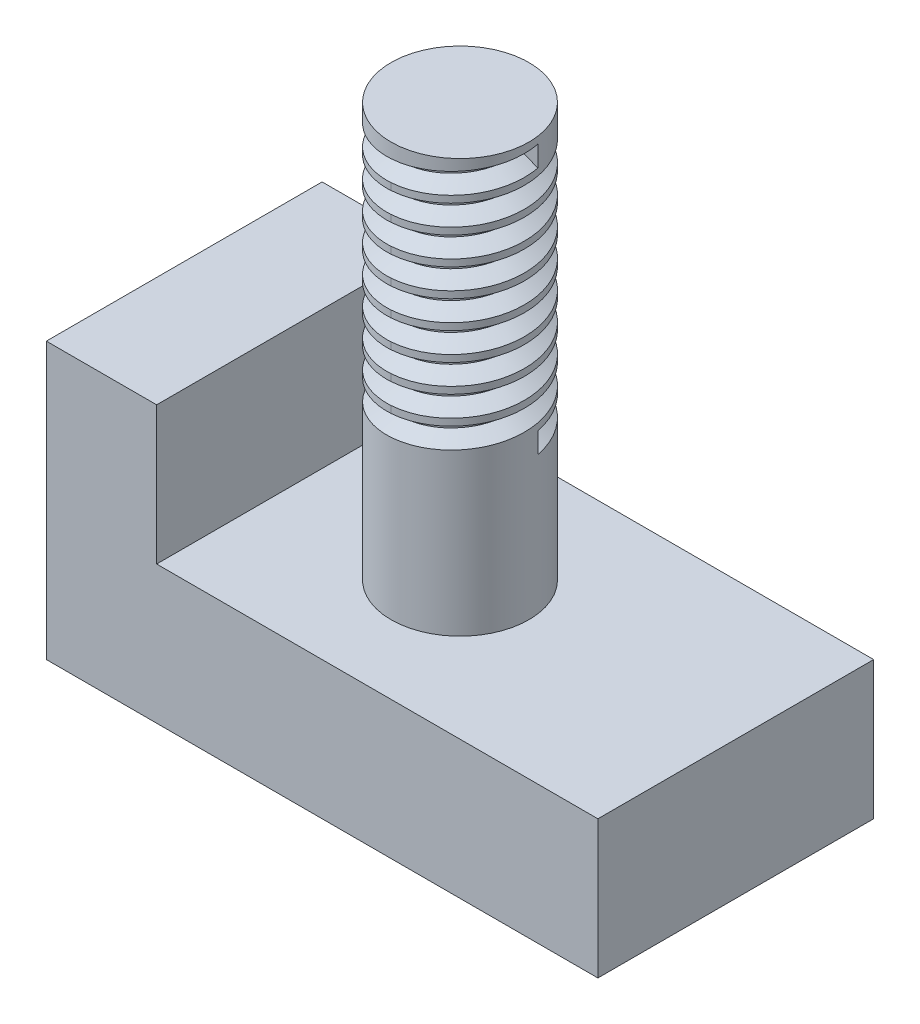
SolidWorks part; units mm, degrees
ref_plane "Front Plane" through (0, 0, 0) normal (0, 0, 1) x (1, 0, 0)
ref_plane "Top Plane" through (0, 0, 0) normal (0, 1, 0) x (1, 0, 0)
ref_plane "Right Plane" through (0, 0, 0) normal (1, 0, 0) x (0, 0, -1)
sketch "Sketch1" plane through (0, 0, 0) normal (0, 1, 0) x (1, 0, 0)
  circle A0 centre (0, 0) radius 2.5
  dimension "D1" = 5
extrude "Boss-Extrude1" add sketch "Sketch1" along normal blind 15
sketch "Sketch4" plane through (0, 0, 0) normal (0, -1, 0) x (1, 0, 0)
  line L1 (-10, -5) -> (10, -5)
  line L2 (-10, -5) -> (-10, 5)
  line L3 (-10, 5) -> (10, 5)
  line L4 (10, -5) -> (10, 5)
  line L5 (-10, -5) -> (10, 5) construction
  line L6 (-10, 5) -> (10, -5) construction
  point P0 (0, 0)
  dimension "D1" = 20
  dimension "D2" = 10
extrude "Boss-Extrude2" add sketch "Sketch4" along normal blind 5
sketch "Sketch5" plane through (0, 0, 0) normal (0, 1, 0) x (1, 0, 0)
  line L0 (10, -5) -> (-10, -5) construction
  line L1 (-10, 5) -> (-6, 5)
  line L2 (-10, 5) -> (-10, -5)
  line L3 (-10, -5) -> (-6, -5)
  line L4 (-6, 5) -> (-6, -5)
  point P7 (-10, 0)
  dimension "D1" = 4
extrude "Boss-Extrude3" add sketch "Sketch5" along normal blind 5
thread "Thread4" pitch 1 start angle 8, offset 0, length 9, pitch 1, diameter 5
ref_plane "Plane8" through (2.4757, 5, -0.3479) normal (0.1392, 0, 0.9903) x (0.9903, 0, -0.1392)
sketch "Thread Profile8" plane through (2.4757, 5, -0.3479) normal (0.1392, 0, 0.9903) x (0.9903, 0, -0.1392)
  line L0 (0, 0) -> (0, 1) construction
  line L1 (0, 0.75) -> (-0.5413, 0.4375)
  line L2 (-0.5413, 0.4375) -> (-0.5413, 0.3125)
  line L3 (-0.5413, 0.3125) -> (0, 0)
  line L4 (-0.5413, 0.375) -> (0, 0.375) construction
  line L11 (0, 0.75) -> (0, 0)
  point P6 (0, 0)
  dimension "Pitch" = 1
  dimension "Profile_Angle" = 60
  dimension "Profile_Land" = 0.125
  dimension "Profile_Height" = 0.5413
